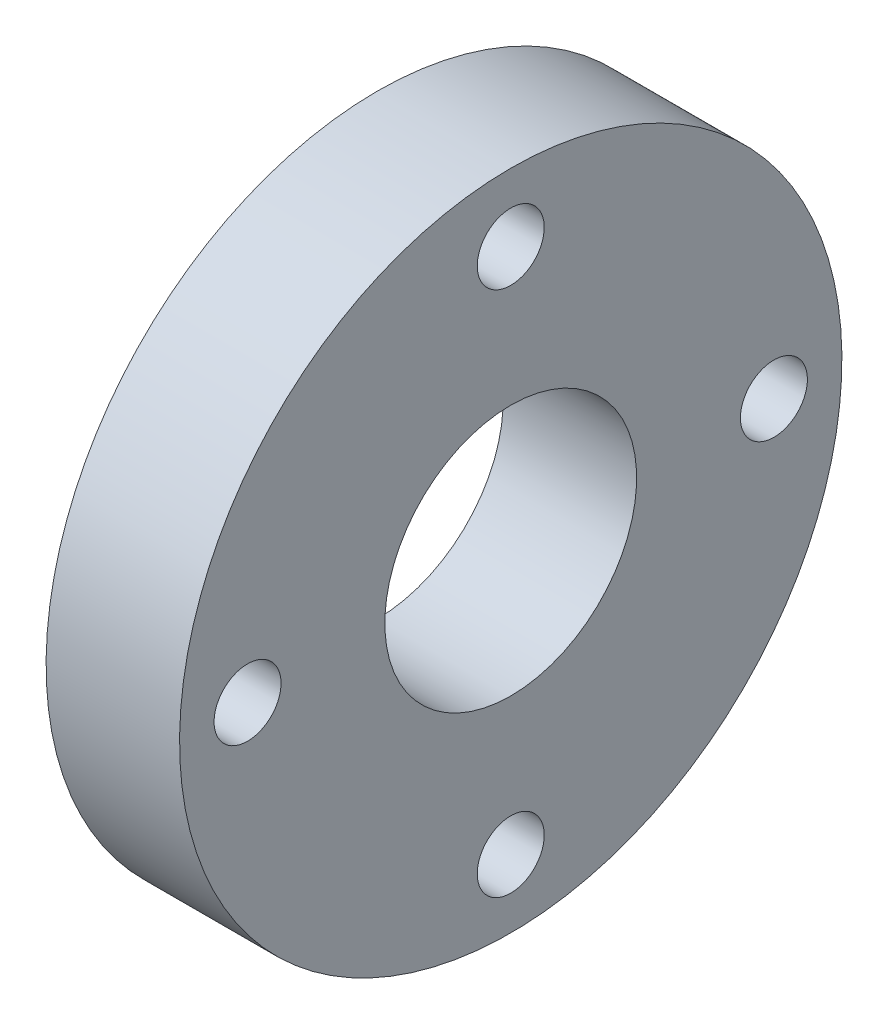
SolidWorks part; units mm, degrees
ref_plane "Front" through (0, 0, 0) normal (0, 0, 1) x (1, 0, 0)
ref_plane "Top" through (0, 0, 0) normal (0, 1, 0) x (1, 0, 0)
ref_plane "Right" through (0, 0, 0) normal (1, 0, 0) x (0, 0, -1)
sketch "Sketch1" plane through (0, 0, 0) normal (0, -1, 0) x (1, 0, 0)
  line L1 (0, 0) -> (-111.1538, 0) construction
  line L4 (-13.462, -33.401) -> (0, -33.401)
  line L5 (-13.462, -33.401) -> (-13.462, -12.7)
  line L6 (-13.462, -12.7) -> (0, -12.7)
  line L7 (0, -33.401) -> (0, -12.7)
  line L8 (-454.787, -12.7) -> (-442.087, -12.7) construction
  line L10 (-473.837, -33.401) -> (-460.375, -33.401) construction
revolve "Base-Revolve" add sketch "Sketch1" angle 360 about L1
sketch "Sketch2" plane through (-13.462, 0, 0) normal (-1, 0, 0) x (0, 0, 1)
  circle A0 centre (-26.543, 0) radius 3.3782 construction
  circle A1 centre (-26.543, 0) radius 3.3782
extrude "Cut-Extrude1" cut sketch "Sketch2" against normal up to next
pattern_circular "CirPattern1" count 4 over 360 about axis through (0, 0, 0) along (1, 0, 0) of "Cut-Extrude1"
